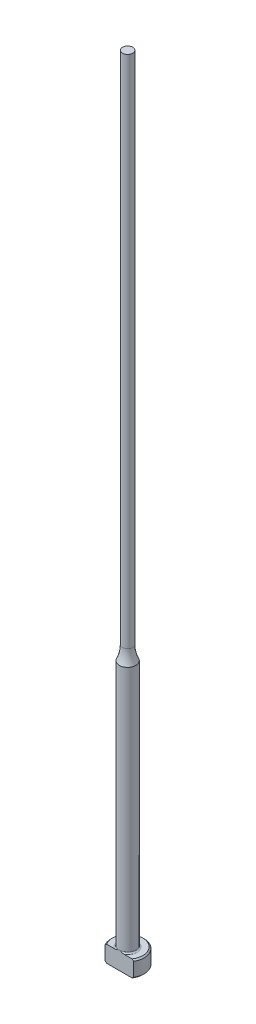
SolidWorks part; units mm, degrees
ref_plane "Front Plane" through (0, 0, 0) normal (0, 0, 1) x (1, 0, 0)
ref_plane "Top Plane" through (0, 0, 0) normal (0, 1, 0) x (1, 0, 0)
ref_plane "Right Plane" through (0, 0, 0) normal (1, 0, 0) x (0, 0, -1)
sketch "Sketch1" plane through (0, 0, 0) normal (0, 0, 1) x (1, 0, 0)
  line L0 (0, 259.9588) -> (0, -15.1925) construction
  line L1 (0, 0) -> (-3.175, 0)
  line L2 (-3.175, 0) -> (-3.175, 3.175)
  line L3 (-3.175, 3.175) -> (-1.5875, 3.175)
  line L4 (-0.9919, 53.4851) -> (-0.9919, 152.4)
  line L5 (-0.9919, 152.4) -> (0, 152.4)
  line L6 (0, 152.4) -> (0, 0)
  line L7 (-1.5875, 3.175) -> (-1.5875, 50.8)
  arc A0 (-1.5875, 50.8) -> (-0.9919, 53.4851) centre (-7.3419, 53.4851) ccw
  point P13 (-1.5875, 0)
  dimension "D1" = 6.35
  dimension "L" = 152.4
  dimension "D2" = 3.175
  dimension "H" = 6.35
  dimension "T" = 3.175
  dimension "D" = 1.9837
  dimension "S" = 50.8
revolve "Revolve1" add sketch "Sketch1" angle 360 about L0
chamfer "Chamfer1" distance 0.254 angle 45 2 edges at (0, 3.175, 3.175) (0, 0, 3.175)
fillet "Fillet1" radius 0.254 1 edges at (0, 3.175, 1.5875)
sketch "Sketch2" plane through (0, 0, 0) normal (0, -1, 0) x (1, 0, 0)
  line L0 (-2.7496, 1.5875) -> (2.7496, 1.5875)
  circle A0 centre (0, 0) radius 3.175 construction
  arc A1 (2.7496, 1.5875) -> (-2.7496, 1.5875) centre (0, 0) ccw
  circle A4 centre (0, 0) radius 1.5875 construction
  dimension "D1" = 0
extrude "KEY" cut sketch "Sketch2" against normal through all
